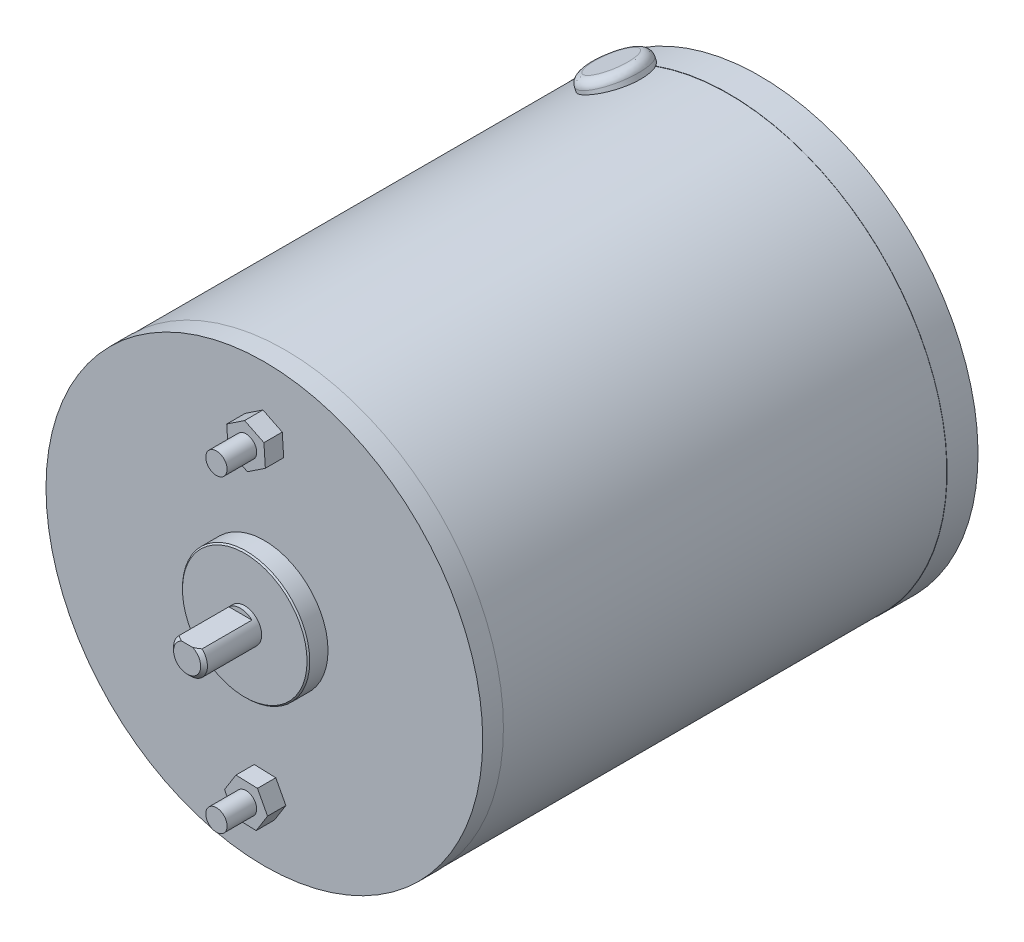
SolidWorks part; units mm, degrees
ref_plane "Front Plane" through (0, 0, 0) normal (0, 0, 1) x (1, 0, 0)
ref_plane "Top Plane" through (0, 0, 0) normal (0, 1, 0) x (1, 0, 0)
ref_plane "Right Plane" through (0, 0, 0) normal (1, 0, 0) x (0, 0, -1)
sketch "Sketch2" plane through (0, 0, 0) normal (0, 0, 1) x (1, 0, 0)
  circle A0 centre (0, 0) radius 40.95
  dimension "D1" = 81.9
extrude "Boss-Extrude1" add sketch "Sketch2" along normal blind 83.312
sketch "Sketch3" plane through (0, 0, 83.312) normal (0, 0, 1) x (1, 0, 0)
  circle A0 centre (0, 0) radius 41
extrude "Boss-Extrude2" add sketch "Sketch3" along normal blind 3.8862
sketch "Sketch4" plane through (0, 0, 87.1982) normal (0, 0, 1) x (1, 0, 0)
  circle A0 centre (0, 0) radius 11.9507
  dimension "D1" = 23.9014
extrude "Boss-Extrude3" add sketch "Sketch4" along normal blind 3.683
sketch "Sketch5" plane through (0, 0, 0) normal (0, 0, -1) x (-1, 0, 0)
  circle A0 centre (0, 0) radius 41
extrude "Boss-Extrude4" add sketch "Sketch5" along normal blind 5.8018
sketch "Sketch6" plane through (0, 0, -5.8018) normal (0, 0, -1) x (-1, 0, 0)
  circle A0 centre (0, 0) radius 12.5
  dimension "D1" = 25
extrude "Boss-Extrude5" add sketch "Sketch6" along normal blind 3
sketch "Sketch7" plane through (0, 0, 87.1982) normal (0, 0, 1) x (1, 0, 0)
  circle A0 centre (0, 0) radius 3.175
  dimension "D1" = 6.35
extrude "Boss-Extrude6" add sketch "Sketch7" along normal blind 14.5
chamfer "Chamfer1" distance 0.635 angle 45 1 edges at (3.175, 0, 101.6982)
sketch "Sketch8" plane through (0, 0, 101.6982) normal (0, 0, 1) x (1, 0, 0)
  line L1 (-4.1348, 3.175) -> (4.6739, 3.175)
  line L2 (-4.1348, 3.175) -> (-4.1348, 2.325)
  line L3 (-4.1348, 2.325) -> (4.6739, 2.325)
  line L4 (4.6739, 3.175) -> (4.6739, 2.325)
  circle A2 centre (0, 0) radius 3.175 construction
  dimension "D1" = 0.85
extrude "Cut-Extrude1" cut sketch "Sketch8" against normal blind 10
sketch "Sketch9" plane through (0, 0, 87.1982) normal (0, 0, 1) x (1, 0, 0)
  circle A0 centre (0, 0) radius 29 construction
  circle A1 centre (0, 29) radius 2
  circle A2 centre (0, -29) radius 2
  circle A3 centre (0, 0) radius 29 construction
  dimension "D1" = 58
  dimension "D2" = 4
  dimension "D3" = 4
extrude "Boss-Extrude7" add sketch "Sketch9" along normal blind 9
sketch "Sketch10" plane through (0, 0, 87.1982) normal (0, 0, 1) x (1, 0, 0)
  line L1 (3.3575, 31.2496) -> (-0.2695, 33.0325)
  line L2 (-0.2695, 33.0325) -> (-3.627, 30.7828)
  line L3 (-3.627, 30.7828) -> (-3.3575, 26.7504)
  line L4 (-3.3575, 26.7504) -> (0.2695, 24.9675)
  line L5 (0.2695, 24.9675) -> (3.627, 27.2172)
  line L6 (3.627, 27.2172) -> (3.3575, 31.2496)
  line L7 (2.1394, -25.5713) -> (-1.8997, -25.4328)
  line L8 (-1.8997, -25.4328) -> (-4.0391, -28.8616)
  line L9 (-4.0391, -28.8616) -> (-2.1394, -32.4287)
  line L10 (-2.1394, -32.4287) -> (1.8997, -32.5672)
  line L11 (1.8997, -32.5672) -> (4.0391, -29.1384)
  line L12 (4.0391, -29.1384) -> (2.1394, -25.5713)
  circle A0 centre (0, 29) radius 3.5 construction
  circle A1 centre (0, -29) radius 3.5 construction
  dimension "D1" = 7
  dimension "D2" = 7
extrude "Boss-Extrude9" add sketch "Sketch10" along normal blind 3.44
ref_plane "Plane1" through (-0.5043, 1.0816, 0) normal (0.4226, -0.9063, 0) x (0, 0, 1)
sketch "Sketch14" plane through (-0.5043, 1.0816, 0) normal (0.4226, -0.9063, 0) x (0, 0, 1)
  line L0 (-5.8018, 41) -> (-5.8018, -41) construction
  ellipse E0 centre (3.8502, 0) end of major axis (-2.2458, 0) minor radius 4.953
  dimension "D1" = 9.906
  dimension "D2" = 12.192
  dimension "D3" = 3.556
  dimension "D4" = 0
extrude "Boss-Extrude10" add sketch "Sketch14" against normal blind 41.91
fillet "Fillet1" radius 1.524 1 edges at (-18.2163, 39.0649, 9.9462)
chamfer "Chamfer2" distance 0.254 angle 45 1 edges at (11.9507, 0, 90.8812)
fillet "Fillet2" radius 0.508 1 edges at (-12.5, 0, -8.8018)
sketch "Sketch15" plane through (0, 0, -5.8018) normal (0, 0, -1) x (-1, 0, 0)
  circle A0 centre (0, 0) radius 29 construction
  circle A1 centre (0, 29) radius 4.2545
  circle A2 centre (0, -29) radius 4.2545
  dimension "D1" = 58
  dimension "D2" = 8.509
extrude "Cut-Extrude2" cut sketch "Sketch15" against normal blind 2.2225
sketch "Sketch16" plane through (0, 0, -3.5793) normal (0, 0, -1) x (-1, 0, 0)
  circle A0 centre (0, -29) radius 3.175
  circle A1 centre (0, 29) radius 3.175
  dimension "D1" = 6.35
extrude "Boss-Extrude11" add sketch "Sketch16" along normal blind 2.2225
sketch "Sketch17" plane through (0, 0, -5.8018) normal (0, 0, -1) x (-1, 0, 0)
  line L0 (0.3175, 29.3175) -> (1.905, 29.3175)
  line L1 (-1.905, 28.6825) -> (-0.3175, 28.6825)
  line L2 (-1.905, 28.6825) -> (-1.905, 29.3175)
  line L3 (-1.905, 29.3175) -> (-0.3175, 29.3175)
  line L4 (1.905, 28.6825) -> (1.905, 29.3175)
  line L5 (-1.905, 28.6825) -> (1.905, 29.3175) construction
  line L6 (-1.905, 29.3175) -> (1.905, 28.6825) construction
  line L7 (-0.3175, 27.095) -> (0.3175, 27.095)
  line L8 (-0.3175, 27.095) -> (-0.3175, 28.6825)
  line L9 (-0.3175, 30.905) -> (0.3175, 30.905)
  line L10 (0.3175, 27.095) -> (0.3175, 28.6825)
  line L11 (-0.3175, 27.095) -> (0.3175, 30.905) construction
  line L12 (-0.3175, 30.905) -> (0.3175, 27.095) construction
  line L13 (-0.3175, 29.3175) -> (-0.3175, 30.905)
  line L14 (0.3175, 29.3175) -> (0.3175, 30.905)
  line L15 (0.3175, 28.6825) -> (1.905, 28.6825)
  point P0 (0, 29)
  point P6 (0, 29)
  dimension "D1" = 0.635
  dimension "D2" = 0.635
  dimension "D3" = 3.81
  dimension "D4" = 3.81
extrude "Cut-Extrude3" cut sketch "Sketch17" against normal blind 1.27
fillet "Fillet3" radius 1.27 2 edges at (-3.175, -29, -5.8018) (-3.175, 29, -5.8018)
mirror "Mirror1" about plane through (0, 0, 0) normal (0, 1, 0) of "Cut-Extrude3"
